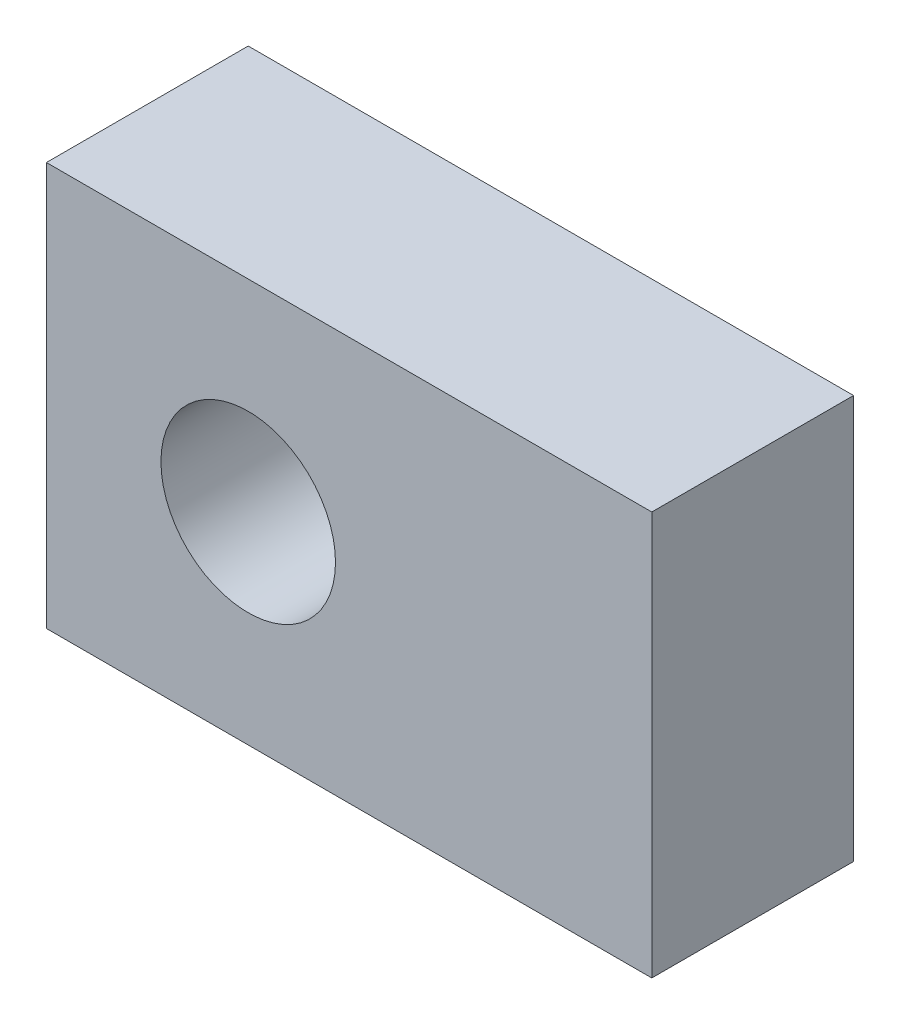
SolidWorks part; units mm, degrees
ref_plane "Płaszczyzna przednia" through (0, 0, 0) normal (0, 0, 1) x (1, 0, 0)
ref_plane "Płaszczyzna górna" through (0, 0, 0) normal (0, 1, 0) x (1, 0, 0)
ref_plane "Płaszczyzna prawa" through (0, 0, 0) normal (1, 0, 0) x (0, 0, -1)
sketch "Szkic1" plane through (0, 0, 0) normal (0, 0, 1) x (1, 0, 0)
  line L1 (60, -20) -> (0, -20)
  line L2 (60, -20) -> (60, 20)
  line L3 (60, 20) -> (0, 20)
  line L4 (0, -20) -> (0, 20)
  circle A0 centre (20, 0) radius 8.65
  point P0 (0, 0)
  dimension "D1" = 17.3
  dimension "D2" = 20
  dimension "D3" = 60
  dimension "D4" = 40
extrude "Dodanie-wyciągnięcie1" add sketch "Szkic1" along normal blind 20
